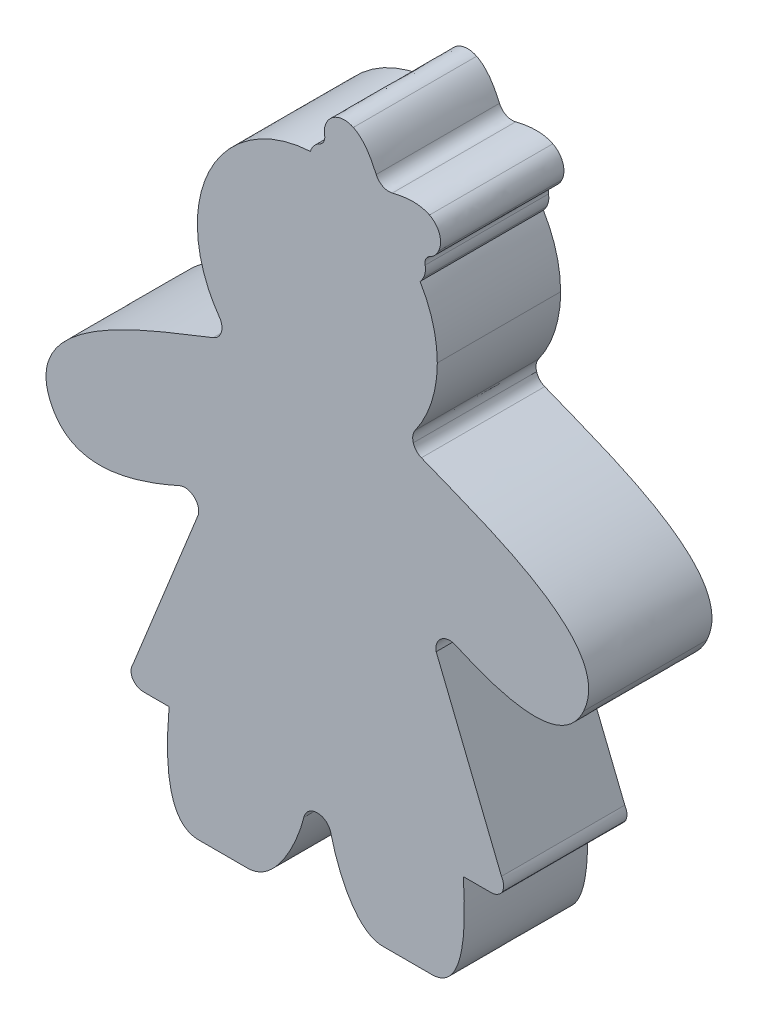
SolidWorks part; units mm, degrees
ref_plane "Front Plane" through (0, 0, 0) normal (0, 0, 1) x (1, 0, 0)
ref_plane "Top Plane" through (0, 0, 0) normal (0, 1, 0) x (1, 0, 0)
ref_plane "Right Plane" through (0, 0, 0) normal (1, 0, 0) x (0, 0, -1)
sketch "Sketch1" plane through (0, 0, 0) normal (0, 0, 1) x (1, 0, 0)
  spline S0 degree 3 poles (422.0588, 280.028) (426.3071, 278.2981) (434.6621, 275.5167) (432.5825, 271.0568) knots 0 0 0 0 0.020833 0.020833 0.020833 0.020833
  spline S1 degree 3 poles (432.5825, 271.0568) (431.2543, 268.2082) (427.7139, 269.0611) (424.2724, 270.6072) knots 0.020833 0.020833 0.020833 0.020833 0.041667 0.041667 0.041667 0.041667
  spline S2 degree 3 poles (424.2724, 270.6072) (423.958, 270.7484) (423.6149, 270.7057) (423.3447, 270.4918) knots 0.041667 0.041667 0.041667 0.041667 0.0625 0.0625 0.0625 0.0625
  spline S3 degree 3 poles (423.3447, 270.4918) (423.0746, 270.2778) (422.9545, 269.9536) (423.0199, 269.6153) knots 0.0625 0.0625 0.0625 0.0625 0.083333 0.083333 0.083333 0.083333
  spline S4 degree 2 poles (423.0199, 269.6153) (423.0199, 269.6153) (427.2558, 259.1112) knots 0.104167 0.104167 0.104167 0.125 0.125 0.125
  spline S5 degree 3 poles (427.2558, 259.1112) (427.4186, 258.8471) (427.437, 258.5451) (427.3076, 258.2633) knots 0.125 0.125 0.125 0.125 0.145833 0.145833 0.145833 0.145833
  spline S6 degree 3 poles (427.3076, 258.2633) (427.1355, 258.0051) (426.8689, 257.8624) (426.5586, 257.8624) knots 0.145833 0.145833 0.145833 0.145833 0.166667 0.166667 0.166667 0.166667
  spline S7 degree 2 poles (426.5586, 257.8624) (426.5586, 257.8624) (424.7767, 257.8624) knots 0.166667 0.166667 0.166667 0.1875 0.1875 0.1875
  spline S8 degree 3 poles (424.7767, 257.8624) (425.0197, 254.3688) (424.7013, 251.3337) (422.7269, 251.3337) knots 0.1875 0.1875 0.1875 0.1875 0.208333 0.208333 0.208333 0.208333
  spline S9 degree 2 poles (422.7269, 251.3337) (422.7269, 251.3337) (419.57, 251.3337) knots 0.208333 0.208333 0.208333 0.229167 0.229167 0.229167
  spline S10 degree 3 poles (419.57, 251.3337) (417.6567, 251.3337) (416.5328, 254.526) (416.1852, 256.0119) knots 0.229167 0.229167 0.229167 0.229167 0.25 0.25 0.25 0.25
  spline S11 degree 3 poles (416.1852, 256.0119) (416.0889, 256.4232) (415.732, 256.7067) (415.309, 256.7067) knots 0.25 0.25 0.25 0.25 0.270833 0.270833 0.270833 0.270833
  spline S12 degree 3 poles (415.309, 256.7067) (414.8859, 256.7066) (414.5292, 256.4231) (414.4329, 256.0119) knots 0.270833 0.270833 0.270833 0.270833 0.291667 0.291667 0.291667 0.291667
  spline S13 degree 3 poles (414.4329, 256.0119) (414.0853, 254.526) (412.6913, 251.3337) (410.7779, 251.3337) knots 0.291667 0.291667 0.291667 0.291667 0.3125 0.3125 0.3125 0.3125
  spline S14 degree 2 poles (410.7779, 251.3337) (410.7779, 251.3337) (407.6212, 251.3337) knots 0.3125 0.3125 0.3125 0.333333 0.333333 0.333333
  spline S15 degree 3 poles (407.6212, 251.3337) (405.647, 251.3337) (405.3876, 254.3688) (405.6936, 257.8624) knots 0.333333 0.333333 0.333333 0.333333 0.354167 0.354167 0.354167 0.354167
  spline S16 degree 2 poles (405.6936, 257.8624) (405.6936, 257.8624) (404.0595, 257.8624) knots 0.354167 0.354167 0.354167 0.375 0.375 0.375
  spline S17 degree 3 poles (404.0595, 257.8624) (403.7493, 257.8624) (403.4826, 258.0051) (403.3106, 258.2633) knots 0.375 0.375 0.375 0.375 0.395833 0.395833 0.395833 0.395833
  spline S18 degree 3 poles (403.3106, 258.2633) (403.1812, 258.5452) (403.1997, 258.8472) (403.3627, 259.1111) knots 0.395833 0.395833 0.395833 0.395833 0.416667 0.416667 0.416667 0.416667
  spline S19 degree 2 poles (403.3627, 259.1111) (403.3627, 259.1111) (407.5982, 269.6154) knots 0.416667 0.416667 0.416667 0.4375 0.4375 0.4375
  spline S20 degree 3 poles (407.5982, 269.6154) (407.6637, 269.9537) (407.5436, 270.2779) (407.2734, 270.4919) knots 0.458333 0.458333 0.458333 0.458333 0.479167 0.479167 0.479167 0.479167
  spline S21 degree 3 poles (407.2734, 270.4919) (407.0033, 270.7058) (406.6602, 270.7485) (406.3458, 270.6073) knots 0.479167 0.479167 0.479167 0.479167 0.5 0.5 0.5 0.5
  spline S22 degree 3 poles (406.3458, 270.6073) (402.9043, 269.0611) (399.3639, 268.2083) (398.0356, 271.0569) knots 0.5 0.5 0.5 0.5 0.520833 0.520833 0.520833 0.520833
  spline S23 degree 3 poles (398.0356, 271.0569) (395.9559, 275.5167) (404.3109, 278.298) (408.5593, 280.028) knots 0.520833 0.520833 0.520833 0.520833 0.541667 0.541667 0.541667 0.541667
  spline S24 degree 3 poles (408.5593, 280.028) (408.8223, 280.1351) (409.004, 280.3367) (409.0836, 280.6094) knots 0.541667 0.541667 0.541667 0.541667 0.5625 0.5625 0.5625 0.5625
  spline S25 degree 3 poles (409.0836, 280.6094) (409.1632, 280.8821) (409.1183, 281.1499) (408.9541, 281.3816) knots 0.5625 0.5625 0.5625 0.5625 0.583333 0.583333 0.583333 0.583333
  spline S26 degree 3 poles (408.9541, 281.3816) (408.0554, 282.6506) (407.5271, 284.2006) (407.5271, 285.874) knots 0.583333 0.583333 0.583333 0.583333 0.604167 0.604167 0.604167 0.604167
  spline S27 degree 3 poles (407.5271, 285.874) (407.5272, 290.018) (410.7664, 293.4048) (414.8509, 293.6421) knots 0.604167 0.604167 0.604167 0.604167 0.625 0.625 0.625 0.625
  spline S28 degree 3 poles (414.8509, 293.6421) (414.8687, 293.6932) (414.8899, 293.7438) (414.9145, 293.7935) knots 0.625 0.625 0.625 0.625 0.645833 0.645833 0.645833 0.645833
  spline S29 degree 3 poles (414.9145, 293.7935) (415.0388, 294.0442) (415.2089, 294.2446) (415.4625, 294.3685) knots 0.645833 0.645833 0.645833 0.645833 0.666667 0.666667 0.666667 0.666667
  spline S30 degree 3 poles (415.4625, 294.3685) (415.7046, 294.4868) (415.8333, 294.7461) (415.7808, 295.0103) knots 0.666667 0.666667 0.666667 0.666667 0.6875 0.6875 0.6875 0.6875
  spline S31 degree 3 poles (415.7808, 295.0103) (415.7259, 295.287) (415.7825, 295.5441) (415.9067, 295.7945) knots 0.6875 0.6875 0.6875 0.6875 0.708333 0.708333 0.708333 0.708333
  spline S32 degree 3 poles (415.9067, 295.7945) (416.2247, 296.4358) (417.0033, 296.6983) (417.6446, 296.3803) knots 0.708333 0.708333 0.708333 0.708333 0.729167 0.729167 0.729167 0.729167
  spline S33 degree 3 poles (417.6446, 296.3803) (418.3366, 296.0371) (418.797, 295.2501) (419.1279, 294.4784) knots 0.729167 0.729167 0.729167 0.729167 0.75 0.75 0.75 0.75
  spline S34 degree 3 poles (419.1279, 294.4784) (419.3034, 294.0693) (419.7415, 293.852) (420.1734, 293.96) knots 0.75 0.75 0.75 0.75 0.770833 0.770833 0.770833 0.770833
  spline S35 degree 3 poles (420.1734, 293.96) (420.988, 294.1638) (421.8932, 294.2738) (422.5852, 293.9307) knots 0.770833 0.770833 0.770833 0.770833 0.791667 0.791667 0.791667 0.791667
  spline S36 degree 3 poles (422.5852, 293.9307) (423.2266, 293.6127) (423.4891, 292.834) (423.1711, 292.1928) knots 0.791667 0.791667 0.791667 0.791667 0.8125 0.8125 0.8125 0.8125
  spline S37 degree 3 poles (423.1711, 292.1928) (423.0468, 291.9421) (422.8767, 291.7417) (422.6231, 291.6178) knots 0.8125 0.8125 0.8125 0.8125 0.833333 0.833333 0.833333 0.833333
  spline S38 degree 3 poles (422.6231, 291.6178) (422.3811, 291.4995) (422.2524, 291.2402) (422.3049, 290.976) knots 0.833333 0.833333 0.833333 0.833333 0.854167 0.854167 0.854167 0.854167
  spline S39 degree 3 poles (422.3049, 290.976) (422.3598, 290.6993) (422.3032, 290.4422) (422.179, 290.1918) knots 0.854167 0.854167 0.854167 0.854167 0.875 0.875 0.875 0.875
  spline S40 degree 3 poles (422.179, 290.1918) (422.1236, 290.0801) (422.0543, 289.98) (421.9741, 289.8924) knots 0.875 0.875 0.875 0.875 0.895833 0.895833 0.895833 0.895833
  spline S41 degree 3 poles (421.9741, 289.8924) (422.6829, 288.7194) (423.0909, 287.3444) (423.0908, 285.874) knots 0.895833 0.895833 0.895833 0.895833 0.916667 0.916667 0.916667 0.916667
  spline S42 degree 3 poles (423.0908, 285.874) (423.0908, 284.2007) (422.5626, 282.6506) (421.664, 281.3816) knots 0.916667 0.916667 0.916667 0.916667 0.9375 0.9375 0.9375 0.9375
  spline S43 degree 3 poles (421.664, 281.3816) (421.4998, 281.1499) (421.4549, 280.8821) (421.5345, 280.6094) knots 0.9375 0.9375 0.9375 0.9375 0.958333 0.958333 0.958333 0.958333
  spline S44 degree 3 poles (421.5345, 280.6094) (421.614, 280.3368) (421.7958, 280.1352) (422.0588, 280.028) knots 0.958333 0.958333 0.958333 0.958333 1 1 1 1
extrude "Boss-Extrude1" add sketch "Sketch1" along normal blind 8
